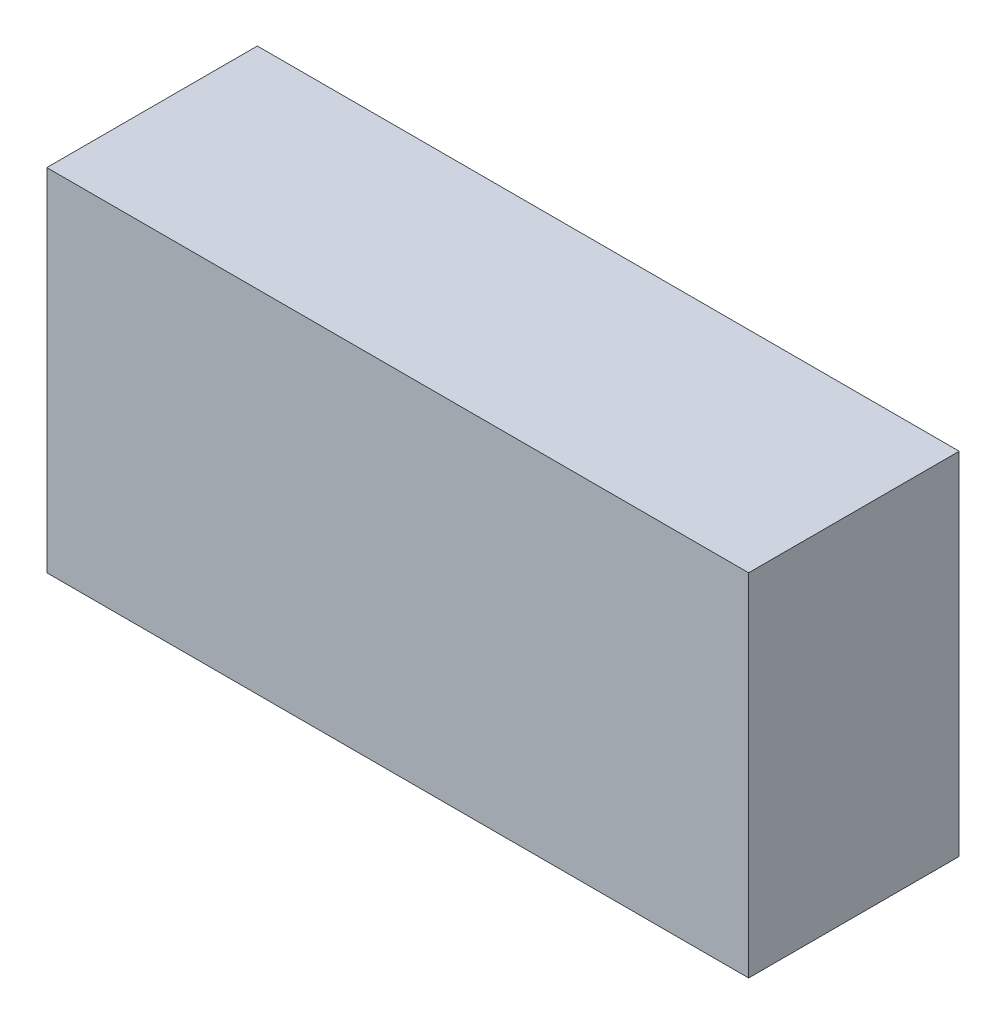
SolidWorks part; units mm, degrees
ref_plane "Ebene oben" through (0, 0, 0) normal (0, 0, 1) x (1, 0, 0)
ref_plane "Ebene vorne" through (0, 0, 0) normal (0, 1, 0) x (1, 0, 0)
ref_plane "Ebene rechts" through (0, 0, 0) normal (1, 0, 0) x (0, 0, -1)
sketch "Skizze1" plane through (0, 0, 0) normal (0, 1, 0) x (1, 0, 0)
  line L1 (50, -15) -> (-50, -15)
  line L2 (50, -15) -> (50, 15)
  line L3 (50, 15) -> (-50, 15)
  line L4 (-50, -15) -> (-50, 15)
  line L5 (50, -15) -> (-50, 15) construction
  line L6 (50, 15) -> (-50, -15) construction
  point P0 (0, 0)
  dimension "D1" = 100
  dimension "D2" = 30
extrude "Aufsatz-Linear austragen1" add sketch "Skizze1" along normal blind 50
